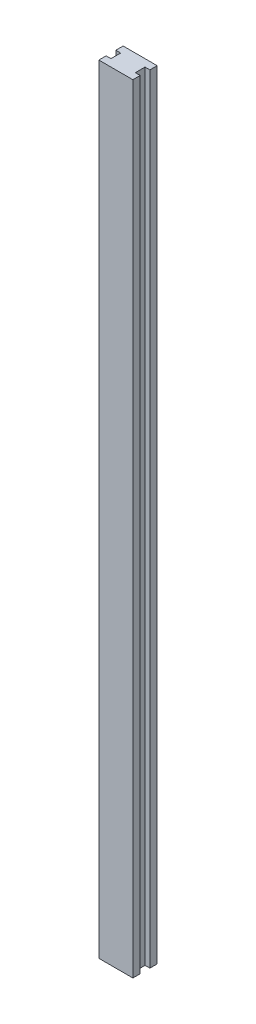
SolidWorks part; units mm, degrees
ref_plane "前视基准面" through (0, 0, 0) normal (0, 0, 1) x (1, 0, 0)
ref_plane "上视基准面" through (0, 0, 0) normal (0, 1, 0) x (1, 0, 0)
ref_plane "右视基准面" through (0, 0, 0) normal (1, 0, 0) x (0, 0, -1)
other "Configuration Table"
sketch "草图2" plane through (0, 0, 0) normal (0, 1, 0) x (1, 0, 0)
  line L0 (-3.5, 1) -> (-3.5, 2.5)
  line L1 (-3.5, -2.5) -> (3.5, -2.5)
  line L2 (-3.5, -2.5) -> (-3.5, -1)
  line L3 (-3.5, 2.5) -> (3.5, 2.5)
  line L4 (3.5, -2.5) -> (3.5, -1)
  line L5 (-3.5, -2.5) -> (3.5, 2.5) construction
  line L6 (-3.5, 2.5) -> (3.5, -2.5) construction
  line L7 (-3.5, -1) -> (-2.5, -1)
  line L9 (-3.5, 1) -> (-2.5, 1)
  line L10 (-2.5, -1) -> (-2.5, 1)
  line L11 (-3.5, 0) -> (-2.5, 1) construction
  line L12 (-3.5, 0) -> (-2.5, -1) construction
  line L13 (2.5, -1) -> (3.5, -1)
  line L14 (2.5, -1) -> (2.5, 1)
  line L15 (2.5, 1) -> (3.5, 1)
  line L17 (2.5, -1) -> (3.5, 0) construction
  line L18 (2.5, 1) -> (3.5, 0) construction
  line L19 (3.5, 1) -> (3.5, 2.5)
  point P0 (0, 0)
  point P6 (-3.5, 0)
  point P11 (3.5, 0)
  dimension "D1" = 7
  dimension "D2" = 5
  dimension "D3" = 2
extrude "凸台-拉伸2" add sketch "草图2" along normal blind 160
